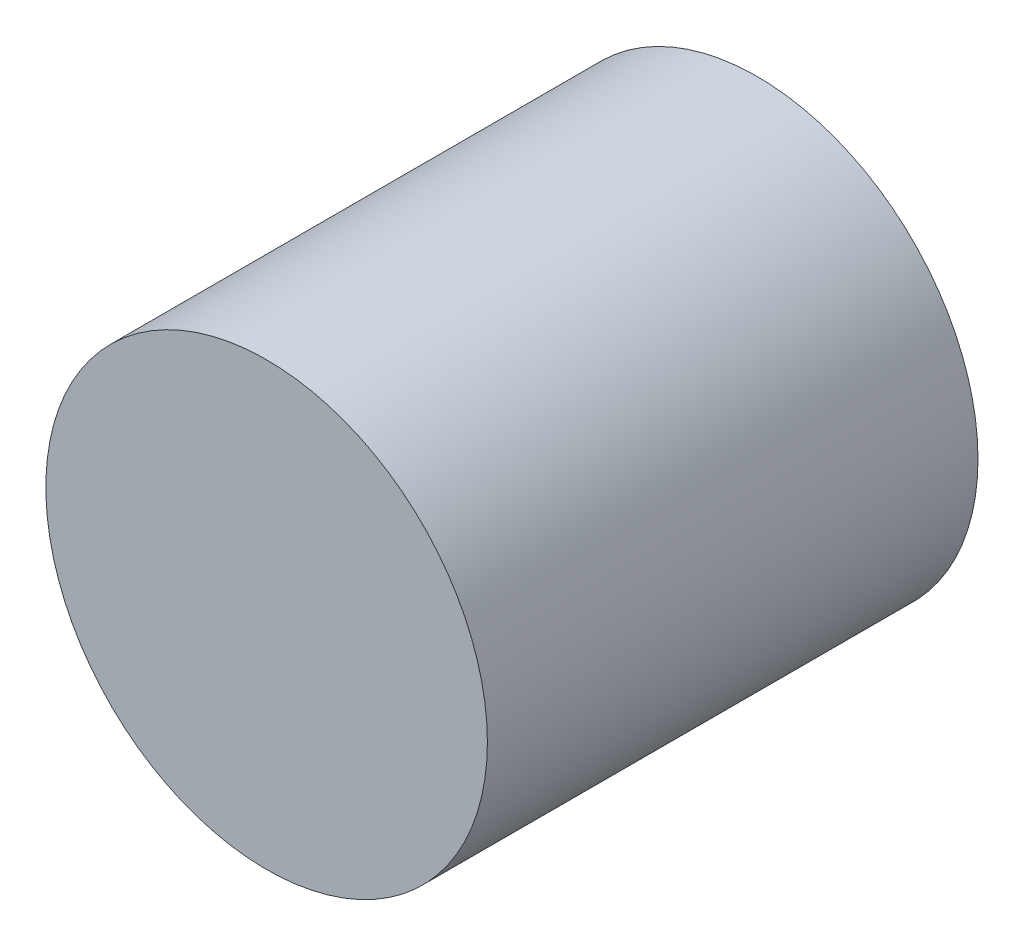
SolidWorks part; units mm, degrees
ref_plane "Alzado" through (0, 0, 0) normal (0, 0, 1) x (1, 0, 0)
ref_plane "Planta" through (0, 0, 0) normal (0, 1, 0) x (1, 0, 0)
ref_plane "Vista lateral" through (0, 0, 0) normal (1, 0, 0) x (0, 0, -1)
sketch "Croquis1" plane through (0, 0, 0) normal (0, 0, 1) x (1, 0, 0)
  circle A0 centre (0, 0) radius 4.5
  dimension "D1" = 9
extrude "Extruir1" add sketch "Croquis1" along normal blind 10
